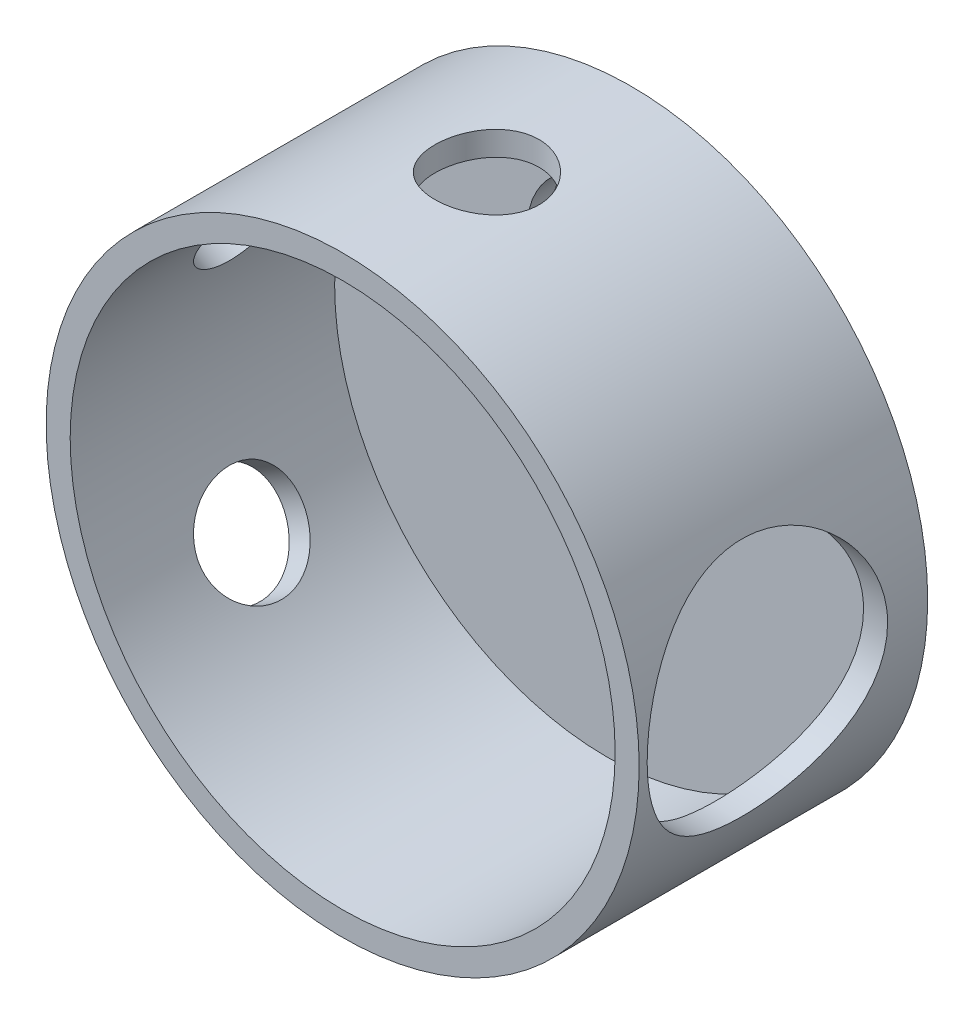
SolidWorks part; units mm, degrees
ref_plane "Plan de face" through (0, 0, 0) normal (0, 0, 1) x (1, 0, 0)
ref_plane "Plan de dessus" through (0, 0, 0) normal (0, 1, 0) x (1, 0, 0)
ref_plane "Plan de droite" through (0, 0, 0) normal (1, 0, 0) x (0, 0, -1)
sketch "Esquisse1" plane through (0, 0, 0) normal (0, 0, 1) x (1, 0, 0)
  circle A0 centre (0, 0) radius 37
  dimension "D1" = 74
extrude "Extrusion1" add sketch "Esquisse1" along normal blind 3
sketch "Esquisse2" plane through (0, 0, 3) normal (0, 0, 1) x (1, 0, 0)
  circle A0 centre (0, 0) radius 34
  dimension "D1" = 68
extrude "Extru.-Mince1" add sketch "Esquisse2" along normal blind 33 thin
ref_plane "Plan1" through (37, 0, 0) normal (1, 0, 0) x (0, 0, -1)
sketch "Esquisse4" plane through (37, 0, 0) normal (1, 0, 0) x (0, 0, -1)
  line L0 (0, -37) -> (0, 37) construction
  line L1 (6.2379, 0) -> (-26.8736, 0) construction
  circle A0 centre (-20, 0) radius 15
  dimension "D1" = 30
  dimension "D2" = 20
extrude "Extrusion2" cut sketch "Esquisse4" against normal blind 15
hole_wizard "Trou taraudé M51" positions "Esquisse7" profile "Esquisse6" tap size "M5" standard "ISO"
sketch "Esquisse7" plane through (0, 0, 3) normal (0, 0, 1) x (1, 0, 0)
  line L0 (0, 22.9607) -> (0, -20.7961) construction
  line L2 (-19.4045, 0) -> (22.033, 0) construction
  line L4 (-19.4045, -17) -> (22.033, -17) construction
  point P0 (0, -17)
  dimension "D1" = 17
sketch "Esquisse6" plane through (0, -17, 3) normal (1, 0, 0) x (0, -1, 0)
  line L0 (0, 0) -> (0, 15.2618)
  line L1 (0, 15.2618) -> (2.1, 14)
  line L2 (2.1, 14) -> (2.1, 0)
  line L5 (2.1, 0) -> (0, 0)
  line L10 (0, 15.2618) -> (-2.1, 14) construction
  line L11 (0, -6.35) -> (0, 107.95) construction
  dimension "Diamètre du trou pour taraudage" = 4.2
  dimension "Profondeur du trou pour taraudage" = 14
  dimension "Angle de pointe" = 118
sketch "Esquisse9" plane through (0, 0, 0) normal (0, 0, -1) x (-1, 0, 0)
  line L0 (0, 35.4755) -> (0, -29.6903) construction
  line L1 (-15.1468, 0) -> (27.3238, 0) construction
  circle A0 centre (0, 18) radius 10
  circle A1 centre (0, 0) radius 37 construction
  dimension "D1" = 20
  dimension "D2" = 18
extrude "Extrusion3" cut sketch "Esquisse9" against normal blind 10
sketch "Esquisse10" plane through (0, 0, 0) normal (0, 1, 0) x (1, 0, 0)
  line L0 (10, 0) -> (-10, 0) construction
  circle A0 centre (0, -18) radius 6.5
  dimension "D1" = 18
  dimension "D2" = 13
extrude "Extrusion4" cut sketch "Esquisse10" along normal through all
pattern_circular "Répétition circulaire1" count 3 every 60 about axis through (0, 0, 3) along (0, 0, -1) of "Extrusion4"
